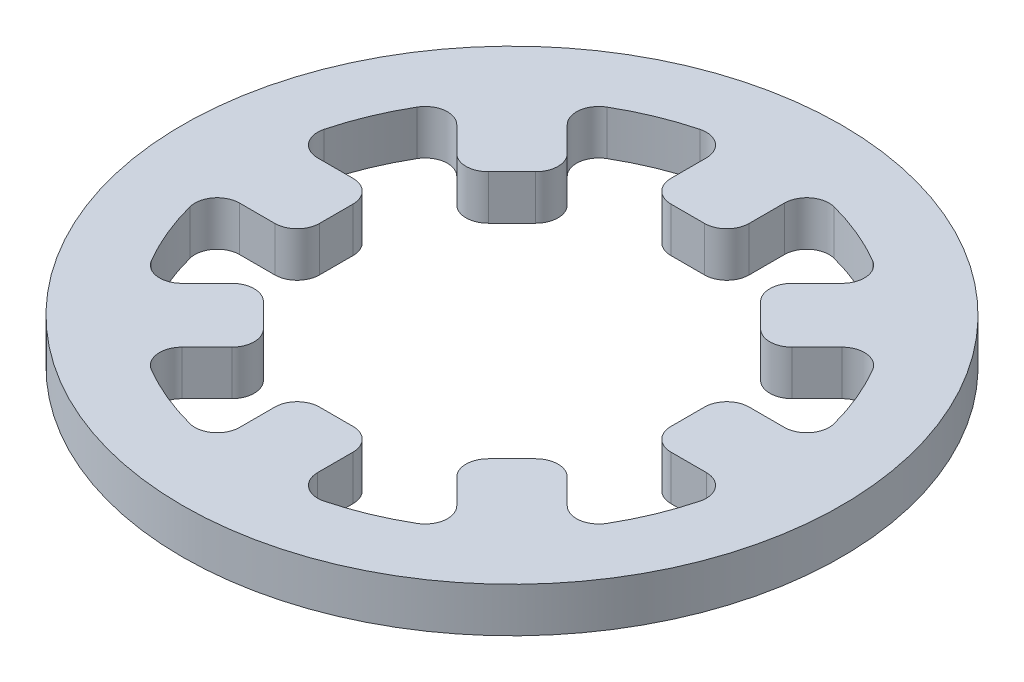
SolidWorks part; units mm, degrees
ref_plane "Front Plane" through (0, 0, 0) normal (0, 0, 1) x (1, 0, 0)
ref_plane "Top Plane" through (0, 0, 0) normal (0, 1, 0) x (1, 0, 0)
ref_plane "Right Plane" through (0, 0, 0) normal (1, 0, 0) x (0, 0, -1)
sketch "Sketch1" plane through (0, 0, 0) normal (0, 1, 0) x (1, 0, 0)
  line L0 (-0.889, 5.3114) -> (-0.889, 4.508)
  line L1 (-0.381, 4) -> (0.381, 4)
  line L2 (0.889, 4.508) -> (0.889, 5.3114)
  line L3 (3.1271, 4.3843) -> (2.559, 3.8163)
  line L4 (3.8163, 2.559) -> (4.3843, 3.1271)
  line L5 (2.559, 3.0978) -> (3.0978, 2.559)
  line L6 (5.3114, 0.889) -> (4.508, 0.889)
  line L7 (4.508, -0.889) -> (5.3114, -0.889)
  line L8 (4, 0.381) -> (4, -0.381)
  line L9 (4.3843, -3.1271) -> (3.8163, -2.559)
  line L10 (2.559, -3.8163) -> (3.1271, -4.3843)
  line L11 (3.0978, -2.559) -> (2.559, -3.0978)
  line L12 (0.889, -5.3114) -> (0.889, -4.508)
  line L13 (-0.889, -4.508) -> (-0.889, -5.3114)
  line L14 (0.381, -4) -> (-0.381, -4)
  line L15 (-3.1271, -4.3843) -> (-2.559, -3.8163)
  line L16 (-3.8163, -2.559) -> (-4.3843, -3.1271)
  line L17 (-2.559, -3.0978) -> (-3.0978, -2.559)
  line L18 (-5.3114, -0.889) -> (-4.508, -0.889)
  line L19 (-4.508, 0.889) -> (-5.3114, 0.889)
  line L20 (-4, -0.381) -> (-4, 0.381)
  line L21 (-4.3843, 3.1271) -> (-3.8163, 2.559)
  line L22 (-2.559, 3.8163) -> (-3.1271, 4.3843)
  line L23 (-3.0978, 2.559) -> (-2.559, 3.0978)
  circle A0 centre (0, 0) radius 7.5
  arc A1 (-1.5262, 5.8026) -> (-3.0239, 5.1823) centre (0, 0) ccw
  arc A2 (-5.1823, 3.0239) -> (-5.8026, 1.5262) centre (0, 0) ccw
  arc A3 (-5.8026, -1.5262) -> (-5.1823, -3.0239) centre (0, 0) ccw
  arc A4 (-3.0239, -5.1823) -> (-1.5262, -5.8026) centre (0, 0) ccw
  arc A5 (1.5262, -5.8026) -> (3.0239, -5.1823) centre (0, 0) ccw
  arc A6 (5.1823, -3.0239) -> (5.8026, -1.5262) centre (0, 0) ccw
  arc A7 (5.8026, 1.5262) -> (5.1823, 3.0239) centre (0, 0) ccw
  arc A8 (3.0239, 5.1823) -> (1.5262, 5.8026) centre (0, 0) ccw
  arc A9 (-3.1271, 4.3843) -> (-3.0239, 5.1823) centre (-2.7679, 4.7435) cw
  arc A10 (-2.559, 3.8163) -> (-2.559, 3.0978) centre (-2.9182, 3.457) cw
  arc A11 (-3.8163, 2.559) -> (-3.0978, 2.559) centre (-3.457, 2.9182) ccw
  arc A12 (-4.3843, 3.1271) -> (-5.1823, 3.0239) centre (-4.7435, 2.7679) ccw
  arc A13 (-5.3114, 0.889) -> (-5.8026, 1.5262) centre (-5.3114, 1.397) cw
  arc A14 (-4.508, 0.889) -> (-4, 0.381) centre (-4.508, 0.381) cw
  arc A15 (-4.508, -0.889) -> (-4, -0.381) centre (-4.508, -0.381) ccw
  arc A16 (-5.3114, -0.889) -> (-5.8026, -1.5262) centre (-5.3114, -1.397) ccw
  arc A17 (-4.3843, -3.1271) -> (-5.1823, -3.0239) centre (-4.7435, -2.7679) cw
  arc A18 (-3.8163, -2.559) -> (-3.0978, -2.559) centre (-3.457, -2.9182) cw
  arc A19 (-2.559, -3.8163) -> (-2.559, -3.0978) centre (-2.9182, -3.457) ccw
  arc A20 (-3.1271, -4.3843) -> (-3.0239, -5.1823) centre (-2.7679, -4.7435) ccw
  arc A21 (-0.889, -5.3114) -> (-1.5262, -5.8026) centre (-1.397, -5.3114) cw
  arc A22 (-0.889, -4.508) -> (-0.381, -4) centre (-0.381, -4.508) cw
  arc A23 (0.889, -4.508) -> (0.381, -4) centre (0.381, -4.508) ccw
  arc A24 (0.889, -5.3114) -> (1.5262, -5.8026) centre (1.397, -5.3114) ccw
  arc A25 (3.1271, -4.3843) -> (3.0239, -5.1823) centre (2.7679, -4.7435) cw
  arc A26 (2.559, -3.8163) -> (2.559, -3.0978) centre (2.9182, -3.457) cw
  arc A27 (3.8163, -2.559) -> (3.0978, -2.559) centre (3.457, -2.9182) ccw
  arc A28 (4.3843, -3.1271) -> (5.1823, -3.0239) centre (4.7435, -2.7679) ccw
  arc A29 (5.3114, -0.889) -> (5.8026, -1.5262) centre (5.3114, -1.397) cw
  arc A30 (4.508, -0.889) -> (4, -0.381) centre (4.508, -0.381) cw
  arc A31 (4.508, 0.889) -> (4, 0.381) centre (4.508, 0.381) ccw
  arc A32 (5.3114, 0.889) -> (5.8026, 1.5262) centre (5.3114, 1.397) ccw
  arc A33 (4.3843, 3.1271) -> (5.1823, 3.0239) centre (4.7435, 2.7679) cw
  arc A34 (3.8163, 2.559) -> (3.0978, 2.559) centre (3.457, 2.9182) cw
  arc A35 (2.559, 3.8163) -> (2.559, 3.0978) centre (2.9182, 3.457) ccw
  arc A36 (3.1271, 4.3843) -> (3.0239, 5.1823) centre (2.7679, 4.7435) ccw
  arc A37 (0.889, 5.3114) -> (1.5262, 5.8026) centre (1.397, 5.3114) cw
  arc A38 (0.381, 4) -> (0.889, 4.508) centre (0.381, 4.508) ccw
  arc A39 (-0.889, 4.508) -> (-0.381, 4) centre (-0.381, 4.508) ccw
  arc A40 (-0.889, 5.3114) -> (-1.5262, 5.8026) centre (-1.397, 5.3114) ccw
  point P8 (-2.2686, 2.3815)
  point P9 (0, 0)
  point P39 (0, 0)
  point P98 (0.889, 4)
  point P101 (-0.889, 4)
  dimension "D1" = 15
  dimension "D2" = 12
  dimension "D6" = 0.508
  dimension "D3" = 4
  dimension "D4" = 1.778
  dimension "D5" = 8
extrude "Boss-Extrude1" add sketch "Sketch1" along normal blind 1.016
